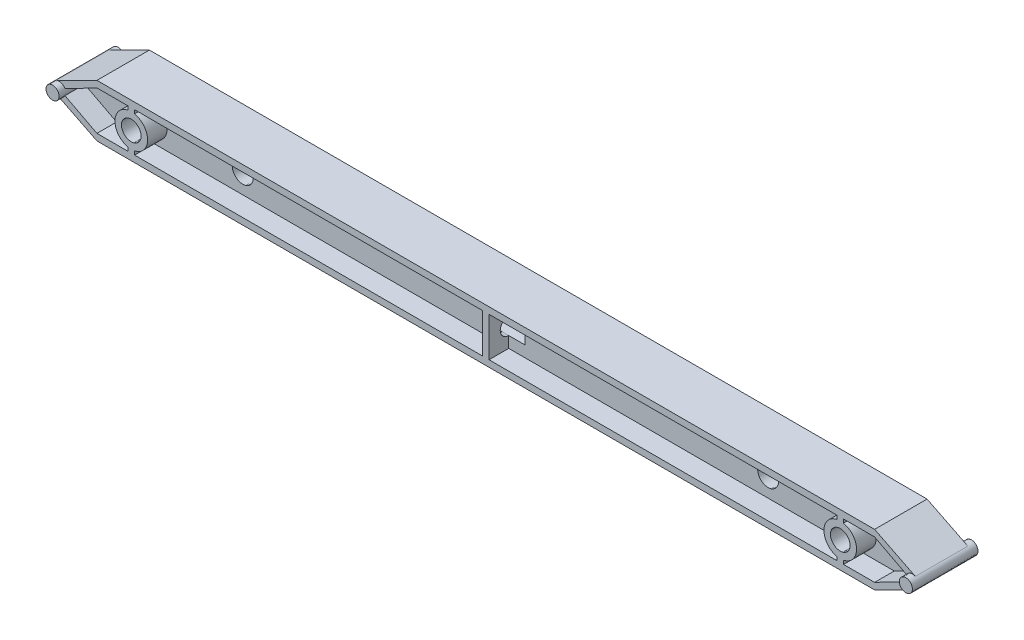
SolidWorks part; units mm, degrees
ref_plane "Front Plane" through (0, 0, 0) normal (0, 0, 1) x (1, 0, 0)
ref_plane "Top Plane" through (0, 0, 0) normal (0, 1, 0) x (1, 0, 0)
ref_plane "Right Plane" through (0, 0, 0) normal (1, 0, 0) x (0, 0, -1)
sketch "Sketch1" plane through (0, 0, 0) normal (0, 0, 1) x (1, 0, 0)
  line L0 (-74.6332, 0) -> (96.2574, 0)
  line L1 (-64.4732, -5.08) -> (-64.4732, 5.08)
  line L2 (-74.6332, 0) -> (-64.4732, 5.08)
  line L3 (-74.6332, 0) -> (-64.4732, -5.08)
  line L4 (86.0974, -5.08) -> (86.0974, 5.08)
  line L5 (86.0974, 5.08) -> (96.2574, 0)
  line L6 (86.0974, -5.08) -> (96.2574, 0)
  line L7 (-64.4732, 5.08) -> (86.0974, 5.08)
  line L8 (-64.4732, -5.08) -> (86.0974, -5.08)
  point P6 (-64.4732, 0)
  point P9 (86.0974, 0)
  dimension "D1" = 170.8906
  dimension "D2" = 90
  dimension "D3" = 10.16
  dimension "D4" = 10.16
  dimension "D5" = 90
  dimension "D6" = 10.16
  dimension "D7" = 10.16
extrude "Boss-Extrude3" add sketch "Sketch1" along normal blind 10.16 contours L2 L0 L1 | L0 L3 L1 | L7 L1 L0 L4 | L1 L8 L4 L0 | L4 L6 L0 | L5 L4 L0
sketch "Sketch4" plane through (0, 0, 10.16) normal (0, 0, 1) x (1, 0, 0)
  line L0 (-74.6332, 0) -> (-64.4732, -5.08) construction
  line L1 (-74.6332, 0) -> (-64.4732, 5.08) construction
  line L2 (86.0974, -5.08) -> (96.2574, 0) construction
  line L3 (86.0974, 5.08) -> (96.2574, 0) construction
  line L4 (86.0974, 5.08) -> (86.0974, 3.81)
  line L5 (86.0974, -5.08) -> (86.0974, -3.81)
  line L6 (86.0974, 3.81) -> (92.291, 0.5863)
  line L7 (86.0974, -3.81) -> (92.291, -0.5863)
  line L8 (-64.4732, 5.08) -> (-64.4732, 3.81)
  line L9 (-64.4732, -5.08) -> (-64.4732, -3.81)
  line L10 (-64.4732, 3.81) -> (-70.6668, 0.5863)
  line L11 (-64.4732, -3.81) -> (-70.6668, -0.5863)
  line L12 (-64.4732, -3.81) -> (86.0974, -3.81)
  line L13 (86.0974, 3.81) -> (-64.4732, 3.81)
  circle A0 centre (-71.7934, 0) radius 1.27
  circle A1 centre (93.4176, 0) radius 1.27
  dimension "D1" = 2.54
  dimension "D2" = 2.54
  dimension "D3" = 1.27
  dimension "D4" = 1.27
  dimension "D5" = 1.27
  dimension "D6" = 1.27
extrude "Cut-Extrude1" cut sketch "Sketch4" against normal blind 3.81 contours A1 L6 L13 L10 A0 L11 L12 L7
sketch "Sketch6" plane through (0, 0, 10.16) normal (0, 0, 1) x (1, 0, 0)
  line L0 (86.0974, -5.08) -> (96.2574, 0) construction
  line L1 (86.0974, 5.08) -> (96.2574, 0) construction
  line L2 (-74.6332, 0) -> (-64.4732, -5.08) construction
  line L3 (-74.6332, 0) -> (-64.4732, 5.08) construction
  circle A0 centre (-71.7934, 0) radius 1.27
  circle A1 centre (93.4176, 0) radius 1.27
  dimension "D1" = 2.54
  dimension "D2" = 2.54
extrude "Boss-Extrude4" add sketch "Sketch6" along normal blind 1.27
sketch "Sketch7" plane through (0, 0, 10.16) normal (0, 0, 1) x (1, 0, 0)
  line L0 (96.2574, 0) -> (93.9855, 1.1359) construction
  line L1 (93.9855, -1.1359) -> (96.2574, 0) construction
  line L2 (-72.3613, 1.1359) -> (-74.6332, 0) construction
  line L3 (-74.6332, 0) -> (-72.3613, -1.1359) construction
  line L4 (96.2574, 0) -> (93.9855, 1.1359)
  line L5 (93.9855, -1.1359) -> (96.2574, 0)
  line L6 (-72.3613, 1.1359) -> (-74.6332, 0)
  line L7 (-74.6332, 0) -> (-72.3613, -1.1359)
  arc A0 (93.9855, -1.1359) -> (93.9855, 1.1359) centre (93.4176, 0) ccw construction
  arc A1 (-72.3613, 1.1359) -> (-72.3613, -1.1359) centre (-71.7934, 0) ccw construction
  arc A2 (93.9855, -1.1359) -> (93.9855, 1.1359) centre (93.4176, 0) ccw
  arc A3 (-72.3613, 1.1359) -> (-72.3613, -1.1359) centre (-71.7934, 0) ccw
extrude "Cut-Extrude2" cut sketch "Sketch7" against normal through all
sketch "Sketch9" plane through (0, 0, 0) normal (0, 0, -1) x (-1, 0, 0)
  circle A0 centre (-93.4176, 0) radius 1.27
  circle A1 centre (71.7934, 0) radius 1.27
  arc A2 (72.3613, -1.1359) -> (72.3613, 1.1359) centre (71.7934, 0) ccw construction
  arc A3 (-93.9855, 1.1359) -> (-93.9855, -1.1359) centre (-93.4176, 0) ccw construction
  dimension "D1" = 2.54
  dimension "D2" = 2.54
extrude "Boss-Extrude5" add sketch "Sketch9" along normal blind 1.27
sketch "Sketch10" plane through (0, 0, 0) normal (0, 0, -1) x (-1, 0, 0)
  line L0 (-86.0974, 5.08) -> (-86.0974, 3.81)
  line L1 (-86.0974, -5.08) -> (-86.0974, -3.81)
  line L2 (-86.0974, 3.81) -> (-92.1476, 0)
  line L3 (-86.0974, -3.81) -> (-92.1476, 0)
  line L4 (64.4732, 5.08) -> (64.4732, 3.81)
  line L5 (64.4732, -5.08) -> (64.4732, -3.81)
  line L6 (64.4732, -3.81) -> (70.6668, -0.5863)
  line L7 (64.4732, 3.81) -> (70.6668, 0.5863)
  line L8 (64.4732, -3.81) -> (-86.0974, -3.81)
  line L9 (-86.0974, 3.81) -> (64.4732, 3.81)
  arc A0 (-93.9855, -1.1359) -> (-93.9855, 1.1359) centre (-93.4176, 0) ccw construction
  arc A1 (72.3613, 1.1359) -> (72.3613, -1.1359) centre (71.7934, 0) ccw construction
  circle A2 centre (71.7934, 0) radius 1.27 construction
  dimension "D1" = 1.27
  dimension "D2" = 1.27
  dimension "D3" = 1.27
  dimension "D4" = 1.27
extrude "Cut-Extrude3" cut sketch "Sketch10" against normal blind 3.81 contours L9 L2 L3 L8 L6 L7 M9 M5
sketch "Sketch11" plane through (0, 0, 6.35) normal (0, 0, 1) x (1, 0, 0)
  line L0 (-73.0634, 0) -> (-57.8234, 0)
  line L1 (-57.8234, 0) -> (-40.0434, 0)
  line L2 (94.6876, 0) -> (79.4476, 0)
  line L3 (79.4476, 0) -> (61.6676, 0)
  line L4 (-38.0114, 0) -> (59.6356, 0)
  line L5 (7.0021, 1.651) -> (7.0021, -1.651)
  line L6 (7.0021, 1.651) -> (14.6221, 1.651)
  line L7 (7.0021, -1.651) -> (14.6221, -1.651)
  line L8 (14.6221, 1.651) -> (14.6221, -1.651)
  line L9 (7.0021, 1.651) -> (14.6221, -1.651) construction
  line L10 (7.0021, -1.651) -> (14.6221, 1.651) construction
  circle A0 centre (-71.7934, 0) radius 1.27 construction
  circle A1 centre (-57.8234, 0) radius 1.905
  circle A2 centre (-40.0434, 0) radius 2.032
  circle A3 centre (93.4176, 0) radius 1.27 construction
  circle A4 centre (79.4476, 0) radius 1.905
  circle A5 centre (61.6676, 0) radius 2.032
  point P19 (10.8121, 0)
  point P21 (10.8121, 0)
  dimension "D2" = 3.81
  dimension "D4" = 4.064
  dimension "D7" = 3.81
  dimension "D8" = 4.064
  dimension "D1" = 15.24
  dimension "D3" = 17.78
  dimension "D5" = 15.24
  dimension "D6" = 17.78
  dimension "D9" = 7.62
  dimension "D10" = 3.302
extrude "Cut-Extrude5" cut sketch "Sketch11" against normal through all
sketch "Sketch12" plane through (0, 0, 6.35) normal (0, 0, 1) x (1, 0, 0)
  line L0 (-58.4584, 3.81) -> (-58.4584, -3.81)
  line L1 (-58.4584, 3.81) -> (-57.1884, 3.81)
  line L2 (-58.4584, -3.81) -> (-57.1884, -3.81)
  line L3 (-57.1884, 3.81) -> (-57.1884, -3.81)
  line L4 (-58.4584, 3.81) -> (-57.1884, -3.81) construction
  line L5 (-58.4584, -3.81) -> (-57.1884, 3.81) construction
  line L6 (-71.7934, 0) -> (93.4176, 0) construction
  line L9 (10.1771, 3.81) -> (10.1771, -3.81)
  line L10 (10.1771, 3.81) -> (11.4471, 3.81)
  line L11 (10.1771, -3.81) -> (11.4471, -3.81)
  line L12 (11.4471, 3.81) -> (11.4471, -3.81)
  line L13 (10.1771, 3.81) -> (11.4471, -3.81) construction
  line L14 (10.1771, -3.81) -> (11.4471, 3.81) construction
  line L15 (78.8126, 3.81) -> (78.8126, -3.81)
  line L16 (78.8126, 3.81) -> (80.0826, 3.81)
  line L17 (78.8126, -3.81) -> (80.0826, -3.81)
  line L18 (80.0826, 3.81) -> (80.0826, -3.81)
  line L19 (78.8126, 3.81) -> (80.0826, -3.81) construction
  line L20 (78.8126, -3.81) -> (80.0826, 3.81) construction
  circle A0 centre (-57.8234, 0) radius 3.175
  circle A1 centre (-57.8234, 0) radius 1.905 construction
  circle A2 centre (79.4476, 0) radius 3.175
  circle A3 centre (79.4476, 0) radius 1.905 construction
  point P12 (10.8121, 0)
  point P16 (10.8121, 0)
  dimension "D1" = 1.27
  dimension "D4" = 1.27
  dimension "D2" = 1.27
  dimension "D3" = 1.27
  dimension "D5" = 1.27
extrude "Boss-Extrude6" add sketch "Sketch12" along normal blind 3.81
sketch "Sketch13" plane through (10.1771, 0, 0) normal (-1, 0, 0) x (0, 0, 1)
  line L0 (6.35, 1.651) -> (6.35, -1.651) construction
  circle A0 centre (6.35, 0) radius 1.651
extrude "Cut-Extrude6" cut sketch "Sketch13" against normal blind 3.81
sketch "Sketch14" plane through (0, 0, 3.81) normal (0, 0, -1) x (-1, 0, 0)
  line L0 (-80.0826, 3.81) -> (-80.0826, -3.81)
  line L1 (-80.0826, 3.81) -> (-78.8126, 3.81)
  line L2 (-80.0826, -3.81) -> (-78.8126, -3.81)
  line L3 (-78.8126, 3.81) -> (-78.8126, -3.81)
  line L4 (-80.0826, 3.81) -> (-78.8126, -3.81) construction
  line L5 (-80.0826, -3.81) -> (-78.8126, 3.81) construction
  line L6 (57.1884, 3.81) -> (57.1884, -3.81)
  line L7 (57.1884, 3.81) -> (58.4584, 3.81)
  line L8 (57.1884, -3.81) -> (58.4584, -3.81)
  line L9 (58.4584, 3.81) -> (58.4584, -3.81)
  line L10 (57.1884, 3.81) -> (58.4584, -3.81) construction
  line L11 (57.1884, -3.81) -> (58.4584, 3.81) construction
  circle A0 centre (-79.4476, 0) radius 3.175
  circle A1 centre (-79.4476, 0) radius 1.905 construction
  circle A2 centre (57.8234, 0) radius 3.175
  circle A3 centre (57.8234, 0) radius 1.905 construction
  dimension "D1" = 1.27
  dimension "D3" = 1.27
  dimension "D2" = 1.27
  dimension "D4" = 1.27
extrude "Boss-Extrude7" add sketch "Sketch14" along normal blind 3.81 contours A2 L9 L6 M7 | L9 A2 L6 M6 | L6 A2 M6 | L9 A2 M6 | L6 A2 L9 M6 | A2 L6 L9 M11 | A0 L3 L0 M7 | L3 A0 L0 M3 | L0 A0 M3 | L0 A0 L3 M3 | A0 L0 L3 M11 | L3 A0 M3
